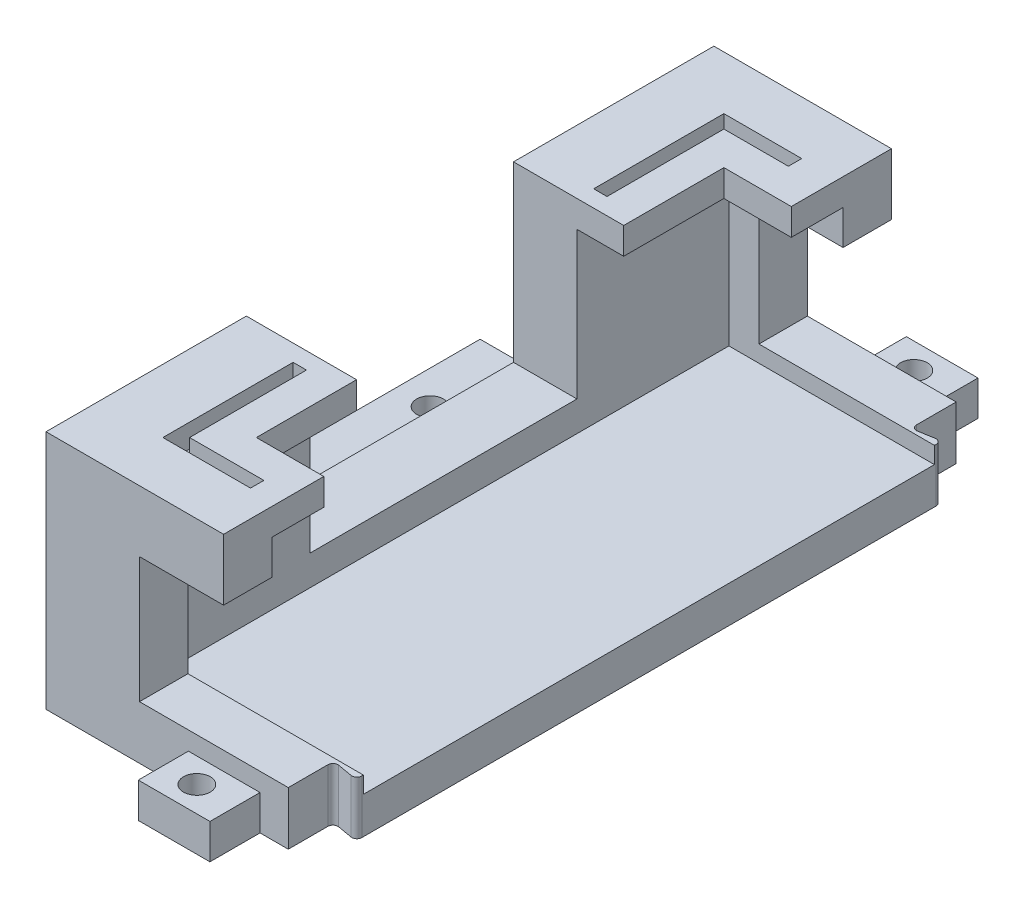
SolidWorks part; units mm, degrees
ref_plane "Front Plane" through (0, 0, 0) normal (0, 0, 1) x (1, 0, 0)
ref_plane "Top Plane" through (0, 0, 0) normal (0, 1, 0) x (1, 0, 0)
ref_plane "Right Plane" through (0, 0, 0) normal (1, 0, 0) x (0, 0, -1)
sketch "Sketch1" plane through (0, 0, 0) normal (0, 1, 0) x (1, 0, 0)
  line L1 (-184.5, -100) -> (184.5, -100)
  line L2 (-184.5, -100) -> (-184.5, 100)
  line L3 (-184.5, 100) -> (184.5, 100)
  line L4 (184.5, -100) -> (184.5, 100)
  line L5 (-184.5, -100) -> (184.5, 100) construction
  line L6 (-184.5, 100) -> (184.5, -100) construction
  point P0 (0, 0)
  dimension "D1" = 200
  dimension "353" = 369
extrude "Boss-Extrude1" add sketch "Sketch1" along normal blind 20
sketch "Sketch2" plane through (0, 20, 0) normal (0, 1, 0) x (1, 0, 0)
  line L0 (-184.5, -100) -> (184.5, -100) construction
  line L1 (-184.5, -100) -> (-151.6166, -100)
  line L2 (-184.5, -100) -> (-184.5, -36.5)
  line L3 (-184.5, -36.5) -> (-165.5, -36.5)
  line L4 (-165.5, -84) -> (-165.5, -36.5)
  line L5 (-184.5, 100) -> (-151.6166, 100)
  line L6 (-184.5, 100) -> (-184.5, 36.5)
  line L7 (-184.5, 36.5) -> (-165.5, 36.5)
  line L8 (-165.5, 84) -> (-165.5, 36.5)
  line L9 (-151.6166, 100) -> (-115.5, 100)
  line L11 (-165.5, 84) -> (-115.5, 84)
  line L12 (-115.5, 100) -> (-115.5, 84)
  line L13 (-151.6166, -100) -> (-115.5, -100)
  line L15 (-165.5, -84) -> (-115.5, -84)
  line L16 (-115.5, -100) -> (-115.5, -84)
  line L17 (-40.5, -100) -> (84.5, -100)
  line L18 (-40.5, -100) -> (-40.5, -84)
  line L19 (-40.5, -84) -> (84.5, -84)
  line L20 (84.5, -100) -> (84.5, -84)
  line L21 (184.5, 100) -> (-184.5, 100) construction
  line L22 (-40.5, 100) -> (84.5, 100)
  line L23 (-40.5, 100) -> (-40.5, 84)
  line L24 (-40.5, 84) -> (84.5, 84)
  line L25 (84.5, 100) -> (84.5, 84)
  line L26 (184.5, -100) -> (184.5, 100) construction
  line L27 (-184.5, 100) -> (-184.5, -100) construction
  point P28 (84.5, -92)
  dimension "D1" = 65
  dimension "D2" = 19
  dimension "D3" = 65
  dimension "D4" = 19
  dimension "D5" = 16
  dimension "D6" = 50
  dimension "D7" = 50
  dimension "D8" = 16
  dimension "D9" = 75
  dimension "D10" = 100
extrude "Boss-Extrude2" add sketch "Sketch2" along normal blind 12
sketch "Sketch3" plane through (0, 20, 0) normal (0, 1, 0) x (1, 0, 0)
  line L0 (-115.5, -84) -> (-165.5, -84) construction
  line L1 (-165.5, 84) -> (176.5, 84)
  line L2 (-165.5, 84) -> (-165.5, -84)
  line L3 (-165.5, -84) -> (176.5, -84)
  line L4 (176.5, 84) -> (176.5, -84)
  dimension "D1" = 342
extrude "Cut-Extrude1" cut sketch "Sketch3" against normal blind 9
sketch "Sketch4" plane through (0, 0, -100) normal (0, 0, -1) x (-1, 0, 0)
  line L0 (-84.5, 32) -> (40.5, 32) construction
  line L1 (-69.5, 20) -> (30.5, 20)
  line L2 (-69.5, 20) -> (-69.5, 32)
  line L3 (-69.5, 32) -> (30.5, 32)
  line L4 (30.5, 20) -> (30.5, 32)
  line L5 (-69.5, 20) -> (30.5, 32) construction
  line L6 (-69.5, 32) -> (30.5, 20) construction
  line L8 (-84.5, 32) -> (-84.5, 20) construction
  point P0 (-19.5, 26)
  dimension "D1" = 100
  dimension "D2" = 15
extrude "Boss-Extrude3" add sketch "Sketch4" along normal blind 60
sketch "Sketch6" plane through (0, 0, -84) normal (0, 0, 1) x (1, 0, 0)
  line L0 (-20.5, 32) -> (-22.7871, 29.1015)
  line L1 (-40.5, 32) -> (84.5, 32) construction
  line L2 (-21.3663, 26.1706) -> (-11.6337, 26.1706)
  line L3 (-10.2129, 29.1015) -> (-12.5, 32)
  line L4 (-12.5, 32) -> (-20.5, 32)
  line L5 (-40.5, 32) -> (84.5, 32) construction
  line L6 (-40.5, 32) -> (-40.5, 20) construction
  line L7 (56.5, 32) -> (54.2501, 28.6971)
  line L8 (55.6337, 26.0806) -> (65.3663, 26.0806)
  line L9 (66.7499, 28.6971) -> (64.5, 32)
  line L10 (64.5, 32) -> (56.5, 32)
  line L12 (84.5, 32) -> (84.5, 20) construction
  arc A0 (-22.7871, 29.1015) -> (-21.3663, 26.1706) centre (-21.3663, 27.9804) ccw
  arc A1 (-11.6337, 26.1706) -> (-10.2129, 29.1015) centre (-11.6337, 27.9804) ccw
  arc A2 (54.2501, 28.6971) -> (55.6337, 26.0806) centre (55.6337, 27.7546) ccw
  arc A3 (65.3663, 26.0806) -> (66.7499, 28.6971) centre (65.3663, 27.7546) ccw
  dimension "D1" = 8
  dimension "D2" = 20
  dimension "D3" = 8
  dimension "D4" = 20
extrude "Cut-Extrude3" cut sketch "Sketch6" against normal blind 60 and the other way blind 10
sketch "Sketch8" plane through (0, 32, 0) normal (0, 1, 0) x (1, 0, 0)
  line L0 (-184.5, 36.5) -> (-165.5, 36.5)
  line L1 (-165.5, 36.5) -> (-165.5, 84)
  line L2 (-165.5, 84) -> (-115.5, 84)
  line L3 (-115.5, 84) -> (-115.5, 100)
  line L4 (-115.5, 100) -> (-184.5, 100)
  line L5 (-184.5, 100) -> (-184.5, 36.5)
extrude "Boss-Extrude5" add sketch "Sketch8" along normal blind 40
sketch "Sketch9" plane through (0, 72, 0) normal (0, 1, 0) x (1, 0, 0)
  line L0 (-115.5, 84) -> (-115.5, 70)
  line L1 (-115.5, 70) -> (-151.5, 70)
  line L2 (-151.5, 70) -> (-151.5, 35)
  line L3 (-151.5, 35) -> (-165.5, 35)
  line L4 (-165.5, 36.5) -> (-165.5, 84) construction
  line L5 (-165.5, 84) -> (-165.5, -84) construction
  line L6 (176.5, 84) -> (-165.5, 84) construction
  dimension "D1" = 14
  dimension "D2" = 14
extrude "Extrude-Thin1" add sketch "Sketch9" against normal blind 7 thin
mirror "Mirror2" about plane through (0, 0, 0) normal (0, 0, 1) of "Boss-Extrude5", "Boss-Extrude3", "Cut-Extrude3", "Extrude-Thin1"
sketch "Sketch10" plane through (0, 32, 0) normal (0, 1, 0) x (1, 0, 0)
  line L1 (-103.95, 161.5046) -> (300.05, 161.5046)
  line L2 (-103.95, 161.5046) -> (-103.95, -163.2916)
  line L3 (-103.95, -163.2916) -> (300.05, -163.2916)
  line L4 (300.05, 161.5046) -> (300.05, -163.2916)
  line L6 (-184.5, 36.5) -> (-184.5, -36.5) construction
  dimension "D1" = 80.55
  dimension "D2" = 404
extrude "Cut-Extrude4" cut sketch "Sketch10" against normal blind 69
sketch "Sketch14" plane through (0, 0, -100) normal (0, 0, -1) x (-1, 0, 0)
  line L5 (115.5, 72) -> (115.5, 20) construction
  line L6 (115.5, 53.6124) -> (156.5, 53.6124)
  line L7 (115.5, 53.6124) -> (115.5, 18.895)
  line L8 (115.5, 18.895) -> (156.5, 18.895)
  line L9 (156.5, 53.6124) -> (156.5, 18.895)
  line L10 (184.5, 72) -> (184.5, 0) construction
  dimension "D1" = 28
extrude "Cut-Extrude7" cut sketch "Sketch14" against normal through all both and the other way through all
sketch "Sketch11" plane through (0, 20, 0) normal (0, 1, 0) x (1, 0, 0)
  line L2 (-103.95, 96.25) -> (-103.95, 87.75)
  line L5 (-103.95, 96.25) -> (-111.95, 97.6606)
  line L6 (-111.95, 97.6606) -> (-111.95, 86.3394)
  line L7 (-111.95, 86.3394) -> (-103.95, 87.75)
  line L8 (-103.95, -84) -> (-103.95, -100) construction
  line L9 (-103.95, 100) -> (-115.5, 100) construction
  line L11 (-103.95, -87.75) -> (-103.95, -96.25)
  line L15 (-103.95, 84) -> (-103.95, 100) construction
  line L18 (-103.95, -87.75) -> (-111.95, -86.3394)
  line L19 (-111.95, -86.3394) -> (-111.95, -97.6606)
  line L20 (-111.95, -97.6606) -> (-103.95, -96.25)
  line L21 (-103.95, -100) -> (-103.95, -84) construction
  line L22 (-115.5, -100) -> (-103.95, -100) construction
  dimension "D2" = 3.75
  dimension "D3" = 80
  dimension "D4" = 80
  dimension "D5" = 80
  dimension "D6" = 3.75
  dimension "D7" = 3.75
  dimension "D8" = 80
  dimension "D9" = 3.75
  dimension "D10" = 8
  dimension "D11" = 8
sketch "Sketch12" plane through (-184.5, 0, 0) normal (-1, 0, 0) x (0, 0, 1)
  line L1 (0, 0) -> (-50, 0)
  line L2 (0, 0) -> (0, 11)
  line L3 (0, 11) -> (-50, 11)
  line L4 (-50, 0) -> (-50, 11)
  dimension "D1" = 11
  dimension "D2" = 50
extrude "Boss-Extrude6" add sketch "Sketch12" along normal blind 20
sketch "Sketch13" plane through (0, 11, 0) normal (0, 1, 0) x (1, 0, 0)
  line L0 (-204.5, 0) -> (-204.5, 50) construction
  line L1 (-204.5, 50) -> (-184.5, 50) construction
  circle A0 centre (-194.5, 25) radius 4
  dimension "D1" = 10
  dimension "D2" = 25
extrude "Cut-Extrude6" cut sketch "Sketch13" against normal through all
mirror "Mirror3" about plane through (0, 0, 0) normal (0, 0, 1) of "Cut-Extrude6", "Boss-Extrude6"
extrude "Cut-Extrude9" cut sketch "Sketch11" against normal through all
sketch "Sketch16" plane through (0, 0, 100) normal (0, 0, 1) x (1, 0, 0)
  line L0 (-156.5, 53.6124) -> (-115.5, 53.6124) construction
  line L1 (-115.5, 72) -> (-131.3145, 72)
  line L2 (-115.5, 72) -> (-115.5, 53.6124)
  line L3 (-115.5, 53.6124) -> (-131.3145, 53.6124)
  line L4 (-131.3145, 72) -> (-131.3145, 53.6124)
extrude "Cut-Extrude10" cut sketch "Sketch16" against normal through all
sketch "Sketch18" plane through (0, 72, 0) normal (0, 1, 0) x (1, 0, 0)
  line L1 (-131.3145, -70) -> (-139.2597, -70)
  line L2 (-131.3145, -70) -> (-131.3145, -92.041)
  line L3 (-131.3145, -92.041) -> (-139.2597, -92.041)
  line L4 (-139.2597, -70) -> (-139.2597, -92.041)
extrude "Boss-Extrude8" add sketch "Sketch18" against normal up to vertex
sketch "Sketch19" plane through (0, 72, 0) normal (0, 1, 0) x (1, 0, 0)
  line L1 (-131.3145, 70) -> (-142.1923, 70)
  line L2 (-131.3145, 70) -> (-131.3145, 90.9542)
  line L3 (-131.3145, 90.9542) -> (-142.1923, 90.9542)
  line L4 (-142.1923, 70) -> (-142.1923, 90.9542)
extrude "Boss-Extrude9" add sketch "Sketch19" against normal up to vertex
fillet "Fillet1" radius 1.5 8 edges at (-111.95, 10, -97.6606) (-103.95, 10, -96.25) (-103.95, 10, -87.75) (-111.95, 10, -86.3394) (-103.95, 10, 96.25) (-111.95, 10, 97.6606) (-111.95, 10, 86.3394) (-103.95, 10, 87.75)
sketch "Sketch20" plane through (0, 0, 100) normal (0, 0, 1) x (1, 0, 0)
  line L0 (-156.5, 18.895) -> (-156.5, 53.6124) construction
  line L1 (-146.5, 18.895) -> (-156.5, 18.895)
  line L2 (-146.5, 18.895) -> (-146.5, 15.995)
  line L3 (-146.5, 15.995) -> (-156.5, 15.995)
  line L4 (-156.5, 18.895) -> (-156.5, 15.995)
  dimension "D1" = 2.9
extrude "Cut-Extrude11" cut sketch "Sketch20" against normal through all both and the other way through all
sketch "Sketch21" plane through (-184.5, 0, 0) normal (-1, 0, 0) x (0, 0, 1)
  line L0 (-100, 72) -> (-36.5, 72) construction
  line L1 (-40, 72) -> (-33.1471, 72)
  line L2 (-40, 72) -> (-40, 20)
  line L3 (-40, 20) -> (-33.1471, 20)
  line L4 (-33.1471, 72) -> (-33.1471, 20)
  line L5 (-36.5, 20) -> (36.5, 20) construction
  line L6 (-100, 72) -> (-100, 0) construction
  line L7 (35, 72) -> (40, 72)
  line L8 (35, 72) -> (35, 20)
  line L9 (35, 20) -> (40, 20)
  line L10 (40, 72) -> (40, 20)
  line L11 (100, 72) -> (100, 0) construction
  dimension "D1" = 60
  dimension "D2" = 60
extrude "Cut-Extrude12" cut sketch "Sketch21" against normal through all
sketch "Sketch22" plane through (0, 0, 100) normal (0, 0, 1) x (1, 0, 0)
  line L1 (-146.5, 15.995) -> (-103.3169, 15.995)
  line L2 (-146.5, 15.995) -> (-146.5, 28.4244)
  line L3 (-146.5, 28.4244) -> (-103.3169, 28.4244)
  line L4 (-103.3169, 15.995) -> (-103.3169, 28.4244)
extrude "Cut-Extrude13" cut sketch "Sketch22" against normal through all
sketch "Sketch23" plane through (0, 65, 0) normal (0, -1, 0) x (-1, 0, 0)
  line L0 (161.5, -80) -> (161.5, -45) construction
  line L1 (151.5, -70) -> (131.3145, -70)
  line L3 (156.1731, -84) -> (131.3145, -84)
  line L4 (131.3145, -70) -> (131.3145, -84)
  line L5 (161.5, -73) -> (131.3145, -84) construction
  line L6 (156.1731, -84) -> (131.3145, -70) construction
  line L7 (165.5, -40) -> (165.5, -45) construction
  line L8 (151.5, -40) -> (165.5, -40)
  line L9 (151.5, -40) -> (151.5, -70)
  line L11 (165.5, -40) -> (165.5, -71.5)
  line L15 (156.1731, -84) -> (165.5, -84)
  line L16 (165.5, -71.5) -> (165.5, -84)
  point P0 (146.4072, -78.5)
extrude "Boss-Extrude10" add sketch "Sketch23" along normal blind 1
mirror "Mirror4" about plane through (0, 0, 0) normal (0, 0, 1) of "Boss-Extrude10"
sketch "Sketch24" plane through (-103.95, 0, 0) normal (1, 0, 0) x (0, 0, -1)
  line L0 (-84, 64) -> (-40, 64) construction
  line L1 (-84, 11) -> (-85.5, 11)
  line L2 (-84, 11) -> (-84, 64)
  line L3 (-84, 64) -> (-85.5, 64)
  line L4 (-85.5, 11) -> (-85.5, 64)
  dimension "D1" = 1.5
extrude "Cut-Extrude14" cut sketch "Sketch24" against normal up to surface (61.55 mm away)
mirror "Mirror5" about plane through (0, 0, 0) normal (0, 0, 1) of "Cut-Extrude14"
sketch "Sketch25" plane through (0, 0, 100) normal (0, 0, 1) x (1, 0, 0)
  line L0 (-184.5, 0) -> (-103.95, 0) construction
  line L1 (-141.8616, 0) -> (-120.4075, 0)
  line L2 (-141.8616, 0) -> (-141.8616, 10.4853)
  line L3 (-141.8616, 10.4853) -> (-120.4075, 10.4853)
  line L4 (-120.4075, 0) -> (-120.4075, 10.4853)
extrude "Boss-Extrude11" add sketch "Sketch25" along normal blind 15
sketch "Sketch26" plane through (0, 10.4853, 0) normal (0, 1, 0) x (1, 0, 0)
  circle A0 centre (-131.9664, -107.3588) radius 4
  dimension "D1" = 8
extrude "Cut-Extrude15" cut sketch "Sketch26" against normal blind 15
sketch "Sketch27" plane through (0, 15.995, 0) normal (0, 1, 0) x (1, 0, 0)
  line L0 (-111.95, -88.127) -> (-111.95, -95.873) construction
  line L1 (-103.95, -100) -> (-111.95, -100)
  line L2 (-103.95, -100) -> (-103.95, -89.4261)
  line L3 (-103.95, -89.4261) -> (-111.95, -89.4261)
  line L4 (-111.95, -100) -> (-111.95, -89.4261)
extrude "Cut-Extrude16" cut sketch "Sketch27" against normal through all
mirror "Mirror6" about plane through (0, 0, 0) normal (0, 0, 1) of "Cut-Extrude16", "Cut-Extrude15", "Boss-Extrude11"
